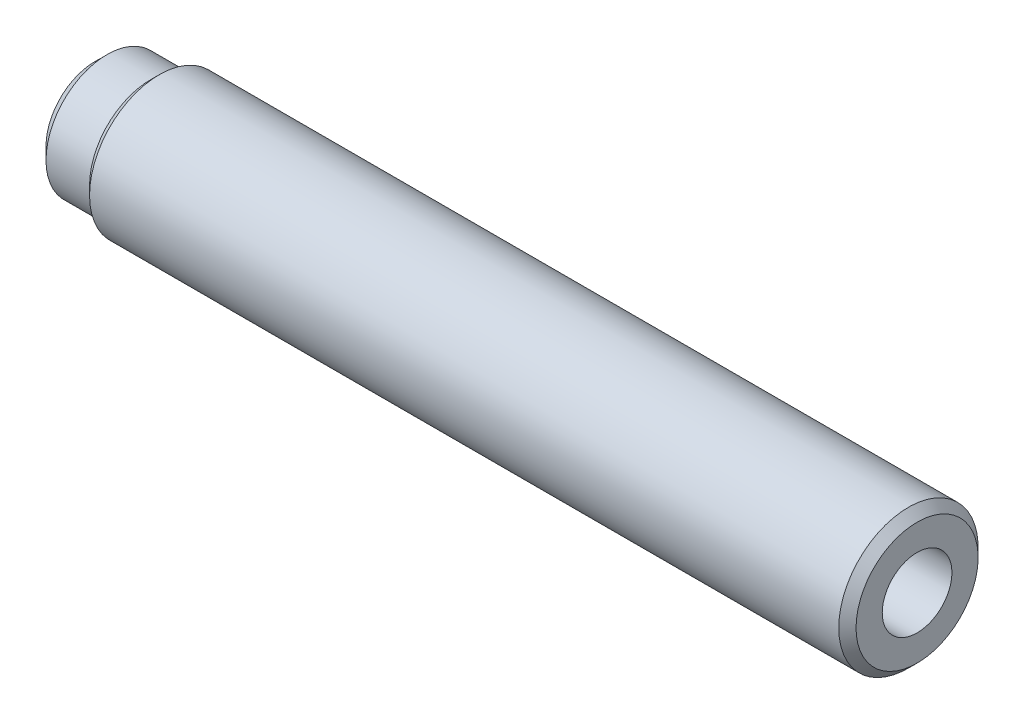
SolidWorks part; units mm, degrees
ref_plane "Front Plane" through (0, 0, 0) normal (0, 0, 1) x (1, 0, 0)
ref_plane "Top Plane" through (0, 0, 0) normal (0, 1, 0) x (1, 0, 0)
ref_plane "Right Plane" through (0, 0, 0) normal (1, 0, 0) x (0, 0, -1)
sketch "Sketch1" plane through (0, 0, 0) normal (0, 0, 1) x (1, 0, 0)
  line L0 (-74.93, 0) -> (-74.93, 4.4501)
  line L1 (-74.93, 4.4501) -> (-73.8175, 5.5626)
  line L2 (-73.8175, 5.5626) -> (-69.85, 5.5626)
  line L3 (-69.85, 5.5626) -> (-69.0626, 6.35)
  line L4 (-69.0626, 6.35) -> (-0.7874, 6.35)
  line L5 (-0.7874, 6.35) -> (0, 5.5626)
  line L6 (0, 5.5626) -> (0, 3.175)
  line L7 (0, 3.175) -> (-21.59, 3.175)
  line L8 (-21.59, 3.175) -> (-21.59, 0)
  line L9 (-21.59, 0) -> (-74.93, 0)
  line L10 (0, 0) -> (-74.93, 0) construction
revolve "Revolve1" add sketch "Sketch1" angle 360 about L10
ref_plane "Plane1" through (-19.05, 0, 0) normal (1, 0, 0) x (0, 0, -1)
ref_plane "Plane2" through (-19.05, 0, 0) normal (1, 0, 0) x (0, 0, -1)
ref_plane "Plane3" through (-21.59, 0, 0) normal (1, 0, 0) x (0, 0, -1)
